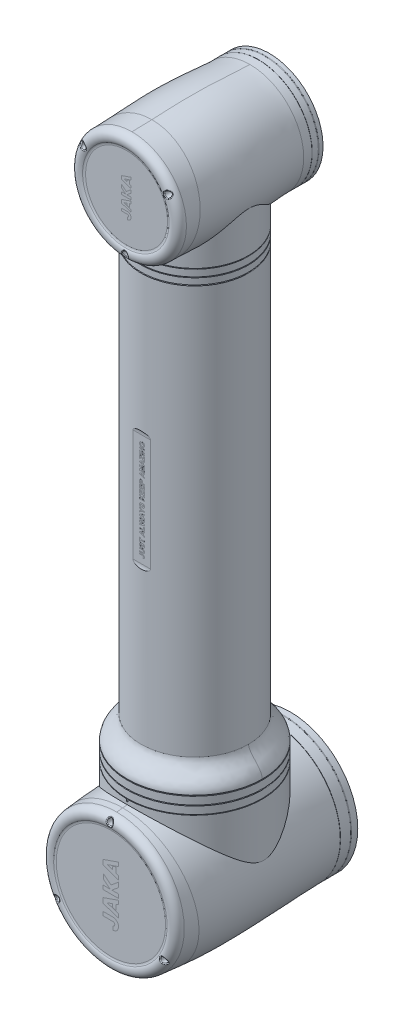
SolidWorks part; units mm, degrees
ref_plane "前视基准面" through (0, 0, 0) normal (0, 0, 1) x (1, 0, 0)
ref_plane "上视基准面" through (0, 0, 0) normal (0, 1, 0) x (1, 0, 0)
ref_plane "右视基准面" through (0, 0, 0) normal (1, 0, 0) x (0, 0, -1)
imported_body "输入1"
imported_body "输入2"
imported_body "输入3"
imported_body "输入4"
imported_body "输入5"
sketch "草图1" plane through (0, 0, 911.6797) normal (0, 0, -1) x (-1, 0, 0)
  line L0 (-107.4829, 518.564) -> (-107.4829, -300.436) construction
ref_plane "基准面1" through (107.4829, 0, 0) normal (1, 0, 0) x (0, 0, -1)
sketch "草图2" plane through (107.4829, 0, 0) normal (1, 0, 0) x (0, 0, -1)
  line L3 (-920.1797, -394.0908) -> (-920.1997, -394.0908)
  line L4 (-920.1797, -394.0908) -> (-920.1797, -393.0171)
  line L5 (-920.1797, -393.0171) -> (-920.1997, -393.0171)
  line L6 (-920.1997, -394.0908) -> (-920.1997, -393.0171)
  line L7 (-921.1797, -393.0043) -> (-921.1597, -393.0043)
  line L8 (-921.1797, -393.0043) -> (-921.1797, -394.0908)
  line L9 (-921.1797, -394.0908) -> (-921.1597, -394.0908)
  line L10 (-921.1597, -393.0043) -> (-921.1597, -394.0908)
  line L11 (-911.6797, -393.436) -> (-911.6797, -210.6049) construction
  line L12 (-911.6797, -300.436) -> (-963.494, -300.436) construction
  line L13 (-911.6797, 518.564) -> (-911.6797, -300.436) construction
  dimension "D1" = 8.5
  dimension "D2" = 0.02
  dimension "D3" = 0.02
  dimension "D4" = 1
revolve "切除-旋转1" cut sketch "草图2" angle 360 about L12
sketch "草图3" plane through (107.4829, 0, 0) normal (1, 0, 0) x (0, 0, -1)
  line L0 (-911.6797, 518.564) -> (-1000.9129, 518.564) construction
  line L1 (-911.6797, 518.564) -> (-911.6797, -300.436) construction
  line L2 (-940.5297, 592.564) -> (-955.4797, 592.564) construction
  line L3 (-946.0497, 592.564) -> (-946.0297, 592.564)
  line L4 (-946.0497, 592.564) -> (-946.0497, 591.5777)
  line L5 (-946.0497, 591.5777) -> (-946.0297, 591.5777)
  line L6 (-946.0297, 592.564) -> (-946.0297, 591.5777)
  line L7 (-940.5297, 451.4035) -> (-940.5297, 592.5641) construction
  line L8 (-947.0097, 592.564) -> (-947.0297, 592.564)
  line L9 (-947.0097, 592.564) -> (-947.0097, 591.5777)
  line L10 (-947.0097, 591.5777) -> (-947.0297, 591.5777)
  line L11 (-947.0297, 592.564) -> (-947.0297, 591.5777)
  dimension "D1" = 5.5
  dimension "D2" = 0.02
  dimension "D3" = 0.02
  dimension "D4" = 1
revolve "切除-旋转2" cut sketch "草图3" angle 360 about L0
sketch "草图4" plane through (0, -199.436, 0) normal (0, 1, 0) x (1, 0, 0)
  circle A0 centre (107.4829, -1136.1797) radius 1
  circle A1 centre (107.4829, -1043.1797) radius 93 construction
  dimension "D1" = 2
extrude "切除-拉伸1" cut sketch "草图4" against normal blind 3
sketch "草图5" plane through (0, 439.564, 0) normal (0, -1, 0) x (1, 0, 0)
  circle A0 centre (107.4829, 1117.1797) radius 1
  circle A1 centre (107.4829, 1043.1797) radius 74 construction
  dimension "D1" = 2
extrude "切除-拉伸2" cut sketch "草图5" against normal blind 3
ref_plane "基准面2" through (0, 0, 955.6797) normal (0, 0, -1) x (-1, 0, 0)
sketch "草图8" plane through (0, 0, 955.6797) normal (0, 0, -1) x (-1, 0, 0)
  circle A0 centre (-107.4829, 444.564) radius 1
  circle A1 centre (-107.4829, 518.564) radius 74 construction
  dimension "D1" = 2
extrude "切除-拉伸3" cut sketch "草图8" against normal blind 3
ref_plane "基准面3" through (0, 0, 935.6797) normal (0, 0, -1) x (-1, 0, 0)
sketch "草图10" plane through (0, 0, 935.6797) normal (0, 0, -1) x (-1, 0, 0)
  circle A0 centre (-107.4829, -207.436) radius 1
  circle A1 centre (-107.4829, -300.436) radius 93 construction
  dimension "D1" = 2
extrude "切除-拉伸4" cut sketch "草图10" against normal blind 3
